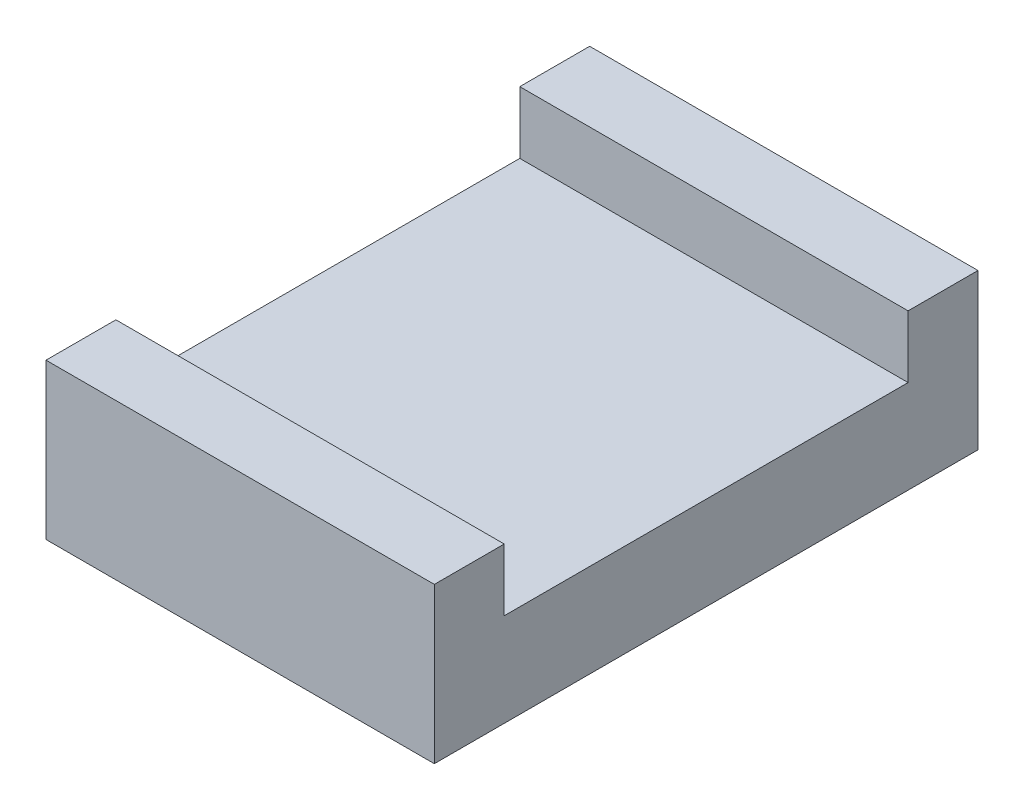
SolidWorks part; units mm, degrees
other "Published References"
other "Ground Plane"
other "Connector1"
other "Connector2"
ref_plane "Front Plane" through (0, 0, 0) normal (0, 0, 1) x (1, 0, 0)
ref_plane "Top Plane" through (0, 0, 0) normal (0, 1, 0) x (1, 0, 0)
ref_plane "Right Plane" through (0, 0, 0) normal (1, 0, 0) x (0, 0, -1)
sketch "Sketch1" plane through (0, 0, 0) normal (1, 0, 0) x (0, 0, -1)
  line L0 (-35, 0) -> (35, 0)
  line L1 (35, 0) -> (35, 20)
  line L2 (35, 20) -> (26, 20)
  line L3 (26, 20) -> (26, 12)
  line L4 (26, 12) -> (-26, 12)
  line L5 (-26, 12) -> (-26, 20)
  line L6 (-26, 20) -> (-35, 20)
  line L7 (-35, 20) -> (-35, 0)
  line L8 (0, 12) -> (0, 0) construction
  dimension "D1" = 70
  dimension "D2" = 20
  dimension "D3" = 9
  dimension "D4" = 12
extrude "Boss-Extrude1" add sketch "Sketch1" along normal mid plane 50
